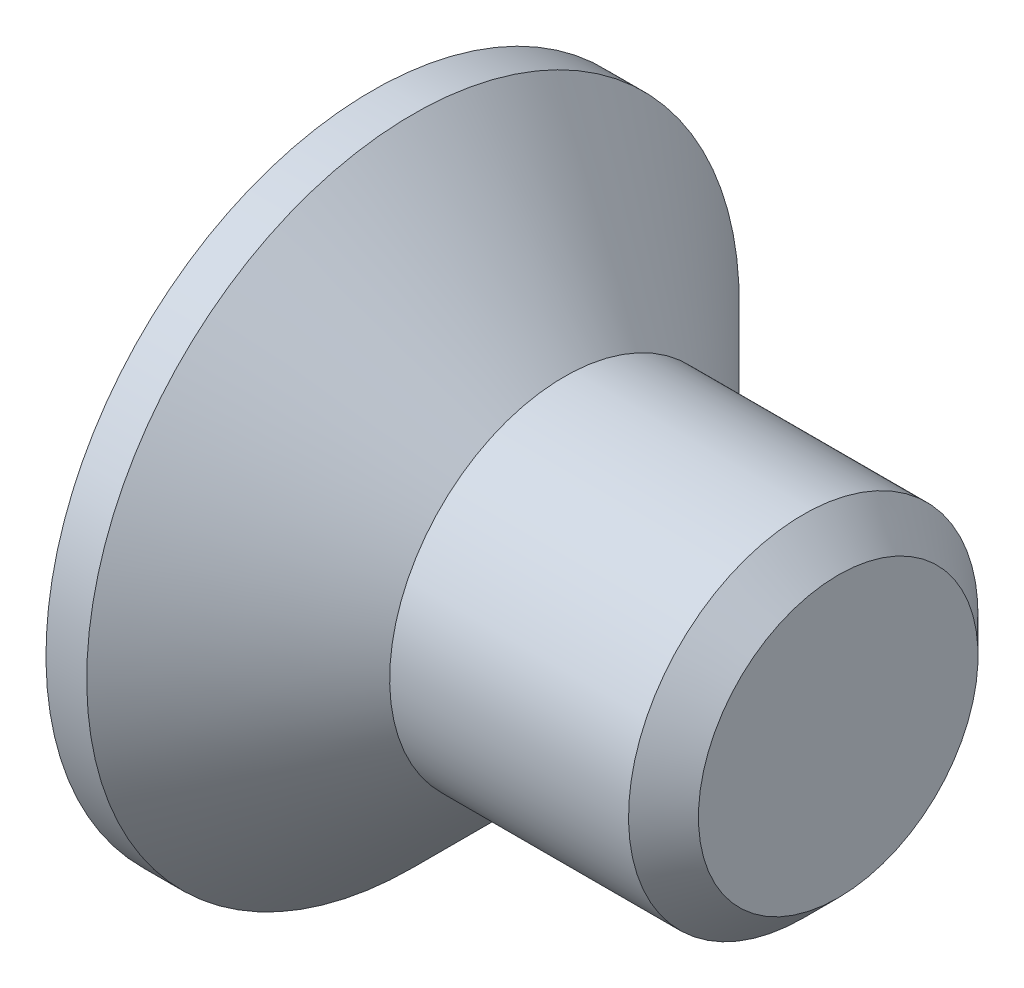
SolidWorks part; units mm, degrees
ref_plane "Front Plane" through (0, 0, 0) normal (0, 0, 1) x (1, 0, 0)
ref_plane "Top Plane" through (0, 0, 0) normal (0, 1, 0) x (1, 0, 0)
ref_plane "Right Plane" through (0, 0, 0) normal (1, 0, 0) x (0, 0, -1)
sketch "Sketch1" plane through (0, 0, 0) normal (0, 0, 1) x (1, 0, 0)
  line L1 (-1.65, 2.8) -> (-1.65, 0)
  line L2 (-1.65, 0) -> (2.35, 0)
  line L3 (2.35, 0) -> (2.35, 1.5)
  line L4 (2.35, 1.5) -> (0, 1.5)
  line L5 (-1.65, 2.8) -> (-1.3, 2.8)
  line L6 (-1.3, 2.8) -> (0, 1.5)
  dimension "D1" = 1.5
  dimension "D2" = 45
  dimension "D3" = 1.65
  dimension "D4" = 4
  dimension "D5" = 2.8
revolve "Revolve1" add sketch "Sketch1" angle 360 about L2
chamfer "Chamfer1" distance 0.3 angle 45 1 edges at (2.35, -1.5, 0)
sketch "Sketch2" plane through (-1.65, 0, 0) normal (-1, 0, 0) x (0, 0, 1)
  line L0 (-0.365, 1.45) -> (0.365, 1.45)
  line L1 (0.365, 1.45) -> (0.365, 0.365)
  line L2 (0.365, 0.365) -> (1.45, 0.365)
  line L3 (1.45, 0.365) -> (1.45, -0.365)
  line L4 (1.45, -0.365) -> (0.365, -0.365)
  line L5 (0.365, -0.365) -> (0.365, -1.45)
  line L6 (0.365, -1.45) -> (-0.365, -1.45)
  line L7 (-0.365, -1.45) -> (-0.365, -0.365)
  line L8 (-0.365, -0.365) -> (-1.45, -0.365)
  line L9 (-1.45, -0.365) -> (-1.45, 0.365)
  line L10 (-1.45, 0.365) -> (-0.365, 0.365)
  line L11 (-0.365, 0.365) -> (-0.365, 1.45)
  point P2 (0, 1.45)
  point P14 (0, -1.45)
  point P15 (1.45, 0)
  point P16 (-1.45, 0)
  dimension "D1" = 2.9
  dimension "D2" = 0.73
extrude "Cut-Extrude1" cut sketch "Sketch2" against normal blind 1.25
